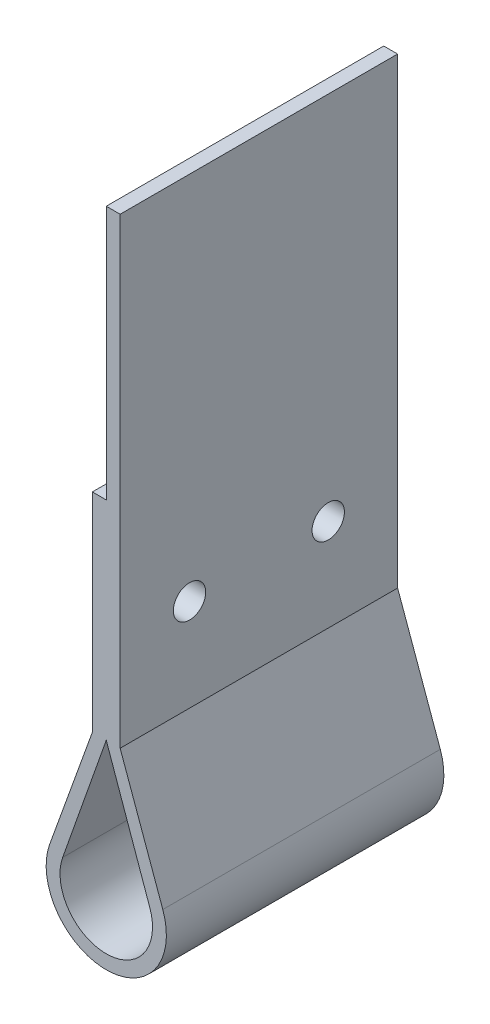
SolidWorks part; units mm, degrees
ref_plane "Plan de face" through (0, 0, 0) normal (0, 0, 1) x (1, 0, 0)
ref_plane "Plan de dessus" through (0, 0, 0) normal (0, 1, 0) x (1, 0, 0)
ref_plane "Plan de droite" through (0, 0, 0) normal (1, 0, 0) x (0, 0, -1)
sketch "Esquisse1" plane through (0, 0, 0) normal (0, 0, 1) x (1, 0, 0)
  line L0 (0, 30) -> (-9.4281, 3.3333)
  line L1 (-3, 75) -> (-3, 30)
  line L2 (3, 130) -> (3, 30)
  line L4 (-3, 30) -> (-12.229, 4.4104)
  line L5 (0, 75) -> (0, 130)
  line L7 (0, 30) -> (9.4281, 3.3333)
  line L8 (3, 30) -> (12.229, 4.4104)
  line L9 (-3, 75) -> (0, 75)
  line L10 (0, 130) -> (3, 130)
  arc A0 (-9.4281, 3.3333) -> (9.4281, 3.3333) centre (0, 0) ccw
  arc A1 (-12.229, 4.4104) -> (12.229, 4.4104) centre (0, 0) ccw
  dimension "D1" = 20
  dimension "D2" = 26
  dimension "D3" = 3
  dimension "D4" = 3
  dimension "D6" = 45
  dimension "D7" = 100
  dimension "D8" = 100
extrude "Extrusion1" add sketch "Esquisse1" along normal blind 60
sketch "Esquisse2" plane through (-3, 0, 0) normal (-1, 0, 0) x (0, 0, 1)
  line L0 (60, 75) -> (0, 75) construction
  line L1 (0, 75) -> (0, 30) construction
  circle A0 centre (15, 50) radius 3.5
  circle A1 centre (45, 50) radius 3.5
  dimension "D1" = 30
  dimension "D2" = 25
  dimension "D3" = 15
  dimension "D4" = 7
  dimension "D5" = 7
extrude "Extrusion2" cut sketch "Esquisse2" against normal through all
